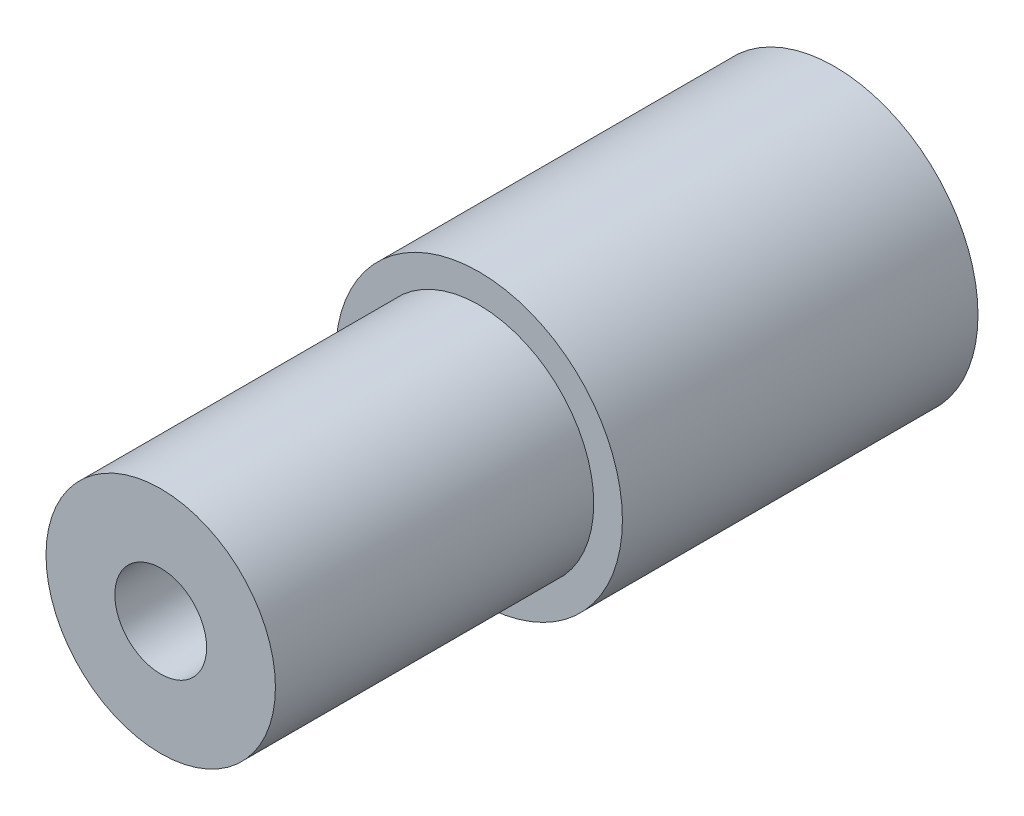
SolidWorks part; units mm, degrees
ref_plane "Front Plane" through (0, 0, 0) normal (0, 0, 1) x (1, 0, 0)
ref_plane "Top Plane" through (0, 0, 0) normal (0, 1, 0) x (1, 0, 0)
ref_plane "Right Plane" through (0, 0, 0) normal (1, 0, 0) x (0, 0, -1)
sketch "Sketch2" plane through (0, 0, 0) normal (0, 0, 1) x (1, 0, 0)
  circle A0 centre (0, 0) radius 4
  circle A1 centre (0, 0) radius 1.6
  dimension "D1" = 8
  dimension "D2" = 3.2
extrude "Boss-Extrude1" add sketch "Sketch2" along normal blind 23.5
sketch "Sketch3" plane through (0, 0, 0) normal (0, 0, -1) x (-1, 0, 0)
  circle A0 centre (0, 0) radius 4 construction
  circle A1 centre (0, 0) radius 4
  circle A2 centre (0, 0) radius 5
  dimension "D1" = 10
extrude "Boss-Extrude2" add sketch "Sketch3" against normal blind 12.4
